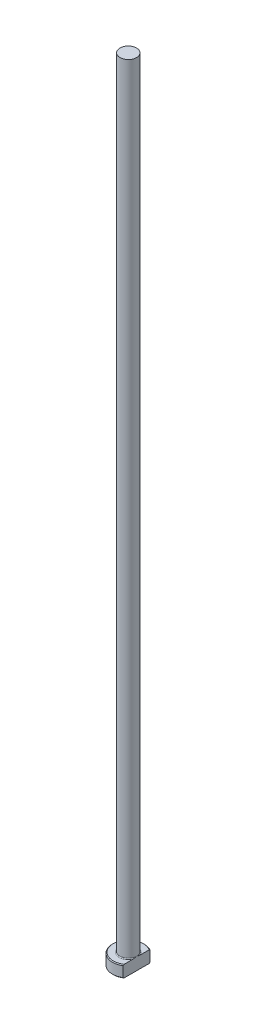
SolidWorks part; units mm, degrees
ref_plane "Front Plane" through (0, 0, 0) normal (0, 0, 1) x (1, 0, 0)
ref_plane "Top Plane" through (0, 0, 0) normal (0, 1, 0) x (1, 0, 0)
ref_plane "Right Plane" through (0, 0, 0) normal (1, 0, 0) x (0, 0, -1)
sketch "Sketch1" plane through (0, 0, 0) normal (0, 0, 1) x (1, 0, 0)
  line L0 (0, 259.9588) -> (0, -15.1925) construction
  line L1 (0, 0) -> (-4, 0)
  line L2 (-4, 0) -> (-4, 3)
  line L3 (-4, 3) -> (-2.1, 3)
  line L4 (-2.1, 3) -> (-2.1, 200)
  line L5 (-2.1, 200) -> (0, 200)
  line L6 (0, 200) -> (0, 0)
  dimension "L" = 200
  dimension "H" = 8
  dimension "T" = 3
  dimension "D" = 4.2
revolve "Revolve1" add sketch "Sketch1" angle 360 about L0
chamfer "Chamfer1" distance 0.2 angle 45 2 edges at (0, 3, 4) (0, 0, 4)
fillet "Fillet1" radius 0.2 1 edges at (0, 3, 2.1)
sketch "Sketch2" plane through (0, 0, 0) normal (0, 1, 0) x (1, 0, 0)
  line L0 (2.1, 3.4044) -> (2.1, -3.4044)
  circle A0 centre (0, 0) radius 4 construction
  arc A1 (2.1, -3.4044) -> (2.1, 3.4044) centre (0, 0) ccw
  circle A2 centre (0, 0) radius 2.1 construction
extrude "KEY" cut sketch "Sketch2" along normal through all
